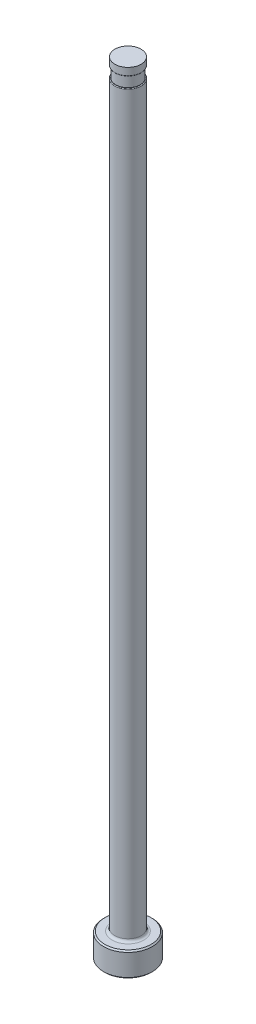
SolidWorks part; units mm, degrees
ref_plane "Front Plane" through (0, 0, 0) normal (0, 0, 1) x (1, 0, 0)
ref_plane "Top Plane" through (0, 0, 0) normal (0, 1, 0) x (1, 0, 0)
ref_plane "Right Plane" through (0, 0, 0) normal (1, 0, 0) x (0, 0, -1)
other "Configuration Table"
sketch "Sketch1" plane through (0, 0, 0) normal (0, 0, 1) x (1, 0, 0)
  line L0 (0, 259.9588) -> (0, -15.1925) construction
  line L1 (0, 0) -> (-4.7625, 0)
  line L2 (-4.7625, 0) -> (-4.7625, 4.7498)
  line L3 (-4.7625, 4.7498) -> (-2.5794, 4.7498)
  line L4 (-2.5794, 4.7498) -> (-2.5794, 152.4)
  line L5 (-2.5794, 152.4) -> (0, 152.4)
  line L6 (0, 152.4) -> (0, 0)
  dimension "L" = 152.4
  dimension "H" = 9.525
  dimension "T" = 4.7498
  dimension "D" = 5.1587
revolve "Revolve1" add sketch "Sketch1" angle 360 about L0
chamfer "Chamfer1" distance 0.254 angle 45 2 edges at (0, 4.7498, 4.7625) (0, 0, 4.7625)
fillet "Fillet1" radius 0.508 1 edges at (0, 4.7498, 2.5794)
sketch "Sketch2" plane through (0, 0, 0) normal (0, 0, 1) x (1, 0, 0)
  line L0 (-2.5794, 152.4) -> (-2.5794, 5.2578) construction
  line L1 (-2.5794, 150.876) -> (-2.3762, 150.876)
  line L2 (-2.5794, 150.876) -> (-2.5794, 148.844)
  line L3 (-2.5794, 148.844) -> (-2.3762, 148.844)
  line L4 (-2.3762, 150.876) -> (-2.3762, 148.844)
  line L5 (2.5794, 152.4) -> (-2.5794, 152.4) construction
  line L6 (0, 153.4483) -> (0, 147.3282) construction
  dimension "D1" = 2.032
  dimension "N" = 1.524
  dimension "FD" = 0.2032
  dimension "D3" = 4.7523
revolve "Vent Relief" cut sketch "Sketch2" angle 360 about L6
sketch "Sketch3" plane through (0, 0, 0) normal (0, 0, 1) x (1, 0, 0)
  line L0 (-2.3762, 149.86) -> (-2.3762, 86.36)
  line L1 (-2.3762, 150.876) -> (-2.3762, 148.844) construction
  line L2 (-2.5794, 148.844) -> (-2.5794, 5.2578) construction
  line L3 (-2.5794, 85.2424) -> (-2.5794, 149.86)
  line L4 (-2.5794, 149.86) -> (-2.3762, 149.86)
  arc A0 (-2.3762, 86.36) -> (-2.5794, 85.2424) centre (-5.5512, 86.36) cw
  dimension "D1" = 3.175
  dimension "D2" = 63.5
extrude "D-Slot" cut sketch "Sketch3" against normal through all both and the other way through all
sketch "Sketch5" plane through (0, 0, 0) normal (0, 0, 1) x (1, 0, 0)
  line L0 (-2.5794, 150.876) -> (2.5794, 150.876) construction
  line L1 (-2.5794, 152.4) -> (-2.554, 152.4)
  line L2 (-2.5794, 152.4) -> (-2.5794, 150.876)
  line L3 (-2.5794, 150.876) -> (-2.554, 150.876)
  line L4 (-2.554, 152.4) -> (-2.554, 150.876)
  line L5 (0, 152.6877) -> (0, 150.5771) construction
  dimension "VP" = 0.0254
revolve "Vent Diameter" cut sketch "Sketch5" angle 360 about L5
fillet "Fillet2" radius 0.127 2 edges at (2.5794, 148.844, 0) (0, 150.876, 2.554)
sketch "Pocket Sketch" plane through (0, 0, 0) normal (0, 0, 1) x (1, 0, 0)
  line L0 (-5.1594, 0) -> (-5.1594, 4.7752)
  line L1 (-5.1594, 4.7752) -> (-3.5398, 4.7752)
  line L2 (-2.7778, 5.5372) -> (-2.7778, 22.225)
  line L3 (-2.7778, 22.225) -> (0, 22.225)
  line L4 (0, 22.225) -> (0, 0)
  line L5 (0, 0) -> (-5.1594, 0)
  line L6 (0, 12.6104) -> (0, -2.4989) construction
  line L7 (-4.7625, 4.4958) -> (-4.7625, 0.254) construction
  line L8 (4.5085, 4.7498) -> (-4.5085, 4.7498) construction
  line L9 (-2.5794, 85.2424) -> (-2.5794, 5.2578) construction
  line L10 (-3.5398, 4.7752) -> (-2.7778, 5.5372)
  point P3 (-2.7778, 4.7752)
  dimension "D1" = 10.3187
  dimension "D2" = 0.3969
  dimension "D3" = 0.0254
  dimension "D4" = 0.1984
  dimension "D5" = 5.5556
  dimension "D6" = 22.225
